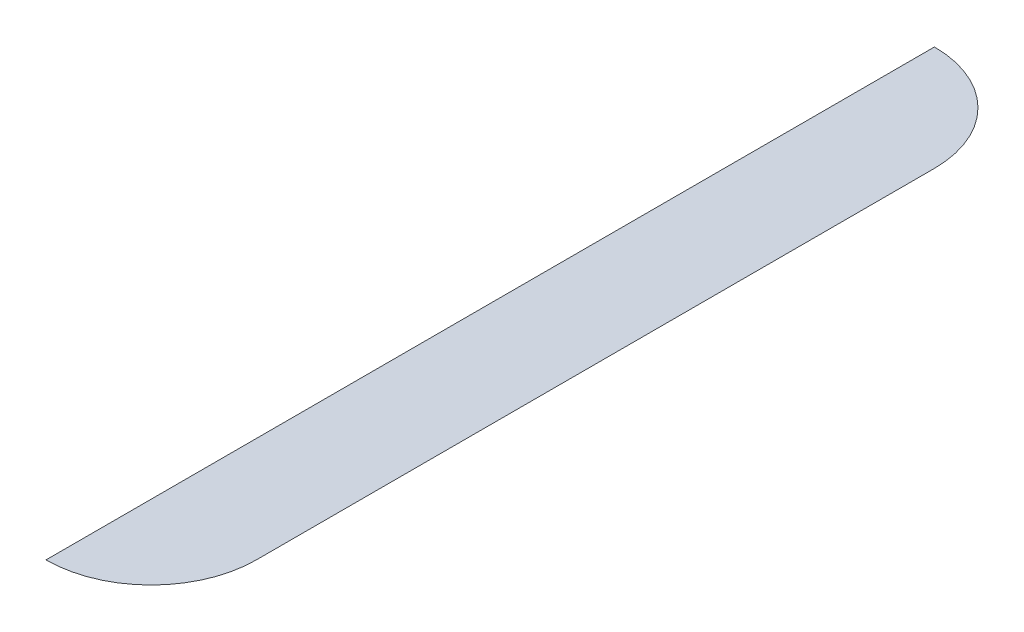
SolidWorks part; units mm, degrees
ref_plane "Plane1" through (0, 0, 0) normal (0, 0, 1) x (1, 0, 0)
ref_plane "Plane2" through (0, 0, 0) normal (0, 1, 0) x (1, 0, 0)
ref_plane "Plane3" through (0, 0, 0) normal (1, 0, 0) x (0, 0, -1)
sketch "Sketch1" plane through (0, 0, 0) normal (0, 0, 1) x (1, 0, 0)
  line L0 (-15, 0) -> (15, 0)
  line L1 (-15, 0) -> (-15, 3.4642)
  line L2 (15, 3.4642) -> (-15, 3.4642)
  line L3 (15, 3.4642) -> (15, 0)
  line L4 (0, 0) -> (0, 3.4642) construction
  line L5 (50, 0) -> (-50, 0) construction
  dimension "D1" = 30
extrude "Base-Extrude" add sketch "Sketch1" along normal mid plane 76.2
sketch "Layout Sketch" plane through (0, 0, 0) normal (0, -1, 0) x (1, 0, 0)
  line L0 (-6.5173, 0) -> (7.2244, 0) construction
  line L1 (11.2638, 0) -> (-11.2638, 0) construction
  line L2 (0, 9.1132) -> (0, -7.6236) construction
  line L3 (0, -50) -> (0, 50) construction
  line L9 (-5.4737, -23.6474) -> (-5.4737, 23.6474)
  line L11 (5.4737, 12.7) -> (5.4737, -12.7)
  arc A0 (5.4737, 12.7) -> (-5.4737, 23.6474) centre (-5.4737, 12.7) ccw
  arc A1 (5.4737, -12.7) -> (-5.4737, -23.6474) centre (-5.4737, -12.7) cw
  dimension "Overall width" = 47.2948
  dimension "Depth" = 10.9474
sketch "Louver Body" plane through (0, 0, 0) normal (0, 0, 1) x (1, 0, 0)
  line L0 (-5.4737, 0) -> (-5.4737, -4.826)
  line L1 (-15, 0) -> (15, 0) construction
  line L2 (-5.4737, 0) -> (5.4737, 0)
  line L4 (5.4737, 0) -> (5.4737, 3.4642) construction
  line L5 (15, 3.4642) -> (-15, 3.4642) construction
  line L6 (-5.4737, -4.826) -> (-3.0249, -4.826) construction
  line L8 (0, 3.4642) -> (0, 0) construction
  arc A0 (-5.4737, -4.826) -> (5.4737, 0) centre (-1.0637, 0) ccw construction
  arc A1 (5.4737, 0) -> (-5.4737, -4.826) centre (-5.4737, 10.0037) cw
  dimension "D1" = 4.826
extrude "Boss-Extrude1" add sketch "Louver Body" along normal mid plane 25.4
sketch "Sketch12" plane through (0, 0, 12.7) normal (0, 0, 1) x (1, 0, 0)
  line L0 (-5.4737, 0) -> (-5.4737, -4.826) construction
  line L1 (-5.4737, 0) -> (-5.4737, -4.826) construction
  line L2 (-15, 0) -> (15, 0) construction
  line L5 (5.4737, 0) -> (-5.4737, 0)
  line L6 (-5.4737, 0) -> (-5.4737, -4.826)
  line L7 (5.4737, 0) -> (-5.4737, 0)
  line L8 (-5.4737, 0) -> (-5.4737, -4.826)
  arc A2 (-5.4737, -4.826) -> (5.4737, 0) centre (-5.4737, 10.0037) ccw
  arc A3 (-5.4737, -4.826) -> (5.4737, 0) centre (-5.4737, 10.0037) ccw
  dimension "D1" = 0
revolve "Boss-Revolve2" add sketch "Sketch12" angle 90 about L1
sketch "Sketch13" plane through (0, 0, -12.7) normal (0, 0, -1) x (-1, 0, 0)
  line L0 (5.4737, -4.826) -> (5.4737, 0) construction
  line L1 (15, 0) -> (-15, 0) construction
  line L2 (5.4737, 0) -> (-5.4737, 0)
  line L3 (5.4737, -4.826) -> (5.4737, 0)
  line L4 (5.4737, 0) -> (-5.4737, 0)
  line L5 (5.4737, -4.826) -> (5.4737, 0)
  arc A1 (-5.4737, 0) -> (5.4737, -4.826) centre (5.4737, 10.0037) ccw
  arc A2 (-5.4737, 0) -> (5.4737, -4.826) centre (5.4737, 10.0037) ccw
  dimension "D1" = 0
revolve "Boss-Revolve3" add sketch "Sketch13" angle 90 about L0
fillet "Fillet1" radius 2.0574 3 edges at (5.4737, 0, 0) (2.2673, 0, 20.441) (2.2673, 0, -20.441)
sketch "Sketch8" plane through (-15, 0, 0) normal (-1, 0, 0) x (0, 0, 1)
  line L4 (-38.1, 0) -> (38.1, 0)
  line L5 (38.1, 0) -> (38.1, 3.4642)
  line L6 (38.1, 3.4642) -> (-38.1, 3.4642)
  line L7 (-38.1, 3.4642) -> (-38.1, 0)
  line L8 (-38.1, 0) -> (38.1, 0)
  line L9 (38.1, 0) -> (38.1, 3.4642)
  line L10 (38.1, 3.4642) -> (-38.1, 3.4642)
  line L11 (-38.1, 3.4642) -> (-38.1, 0)
  dimension "D1" = 0
extrude "Cut-Extrude4" cut sketch "Sketch8" against normal through all
sketch "Orientation sketch" plane through (0, 0, 0) normal (0, 1, 0) x (-1, 0, 0)
  line L2 (5.4737, 24.5196) -> (5.4737, -24.5196)
  line L3 (5.4737, 24.5196) -> (5.4737, -24.5196)
  line L4 (-6.3459, 12.7) -> (-6.3459, -12.7)
  line L5 (-6.3459, 12.7) -> (-6.3459, -12.7)
  arc A2 (5.4737, 24.5196) -> (-6.3459, 12.7) centre (5.4737, 12.7) ccw
  arc A3 (5.4737, 24.5196) -> (-6.3459, 12.7) centre (5.4737, 12.7) ccw
  arc A4 (-6.3459, -12.7) -> (5.4737, -24.5196) centre (5.4737, -12.7) ccw
  arc A5 (-6.3459, -12.7) -> (5.4737, -24.5196) centre (5.4737, -12.7) ccw
  dimension "D1" = 0
other "Move Face1" parameters "D1"=25.4
other "Move Face2" parameters "D1"=25.4, "Width"=25.4
equation "\"Width@Boss-Extrude1\"=\"Overall width@Layout Sketch\"-2*\"Depth@Layout Sketch\""
